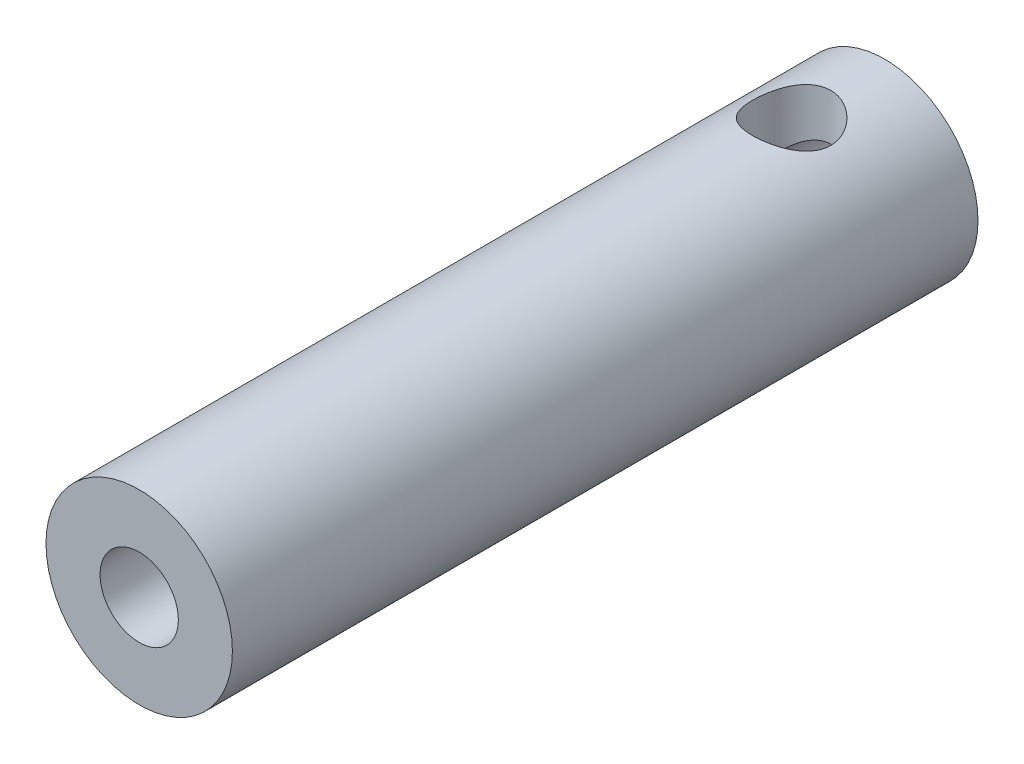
SolidWorks part; units mm, degrees
ref_plane "Piano frontale" through (0, 0, 0) normal (0, 0, 1) x (1, 0, 0)
ref_plane "Piano superiore" through (0, 0, 0) normal (0, 1, 0) x (1, 0, 0)
ref_plane "Piano destro" through (0, 0, 0) normal (1, 0, 0) x (0, 0, -1)
sketch "Schizzo1" plane through (0, 0, 0) normal (0, 0, 1) x (1, 0, 0)
  circle A0 centre (0, 0) radius 5
  dimension "D1" = 10
extrude "Estrusione-Estrusione1" add sketch "Schizzo1" along normal blind 40
hole_wizard "Foro filettato M5-1" positions "Schizzo2" profile "Schizzo3" tap size "M5" standard "ISO"
sketch "Schizzo2" plane through (0, 0, 40) normal (0, 0, 1) x (1, 0, 0)
  point P0 (0, 0)
sketch "Schizzo3" plane through (0, 0, 40) normal (1, 0, 0) x (0, -1, 0)
  line L0 (0, 0) -> (0, 16.2618)
  line L1 (0, 16.2618) -> (2.1, 15)
  line L2 (2.1, 15) -> (2.1, 0)
  line L5 (2.1, 0) -> (0, 0)
  line L10 (0, 16.2618) -> (-2.1, 15) construction
  line L11 (0, -6.35) -> (0, 107.95) construction
  dimension "Tap Drill Dia." = 4.2
  dimension "Tap Drill Depth" = 15
  dimension "Drill Angle" = 118
hole_wizard "Foro Ø5.0 (5)-1" positions "Schizzo4" profile "Schizzo5" hole size "Ø5.0" standard "ISO"
sketch "Schizzo4" plane through (0, 0, 0) normal (0, 0, -1) x (-1, 0, 0)
  point P0 (0, 0)
sketch "Schizzo5" plane through (0, 0, 0) normal (1, 0, 0) x (0, 1, 0)
  line L0 (0, 0) -> (0, 15)
  line L1 (0, 15) -> (2.5, 13.4978)
  line L2 (2.5, 13.4978) -> (2.5, 0)
  line L5 (2.5, 0) -> (0, 0)
  line L10 (0, 15) -> (-2.5, 13.4978) construction
  line L11 (0, -6.35) -> (0, 107.95) construction
  dimension "Hole Dia." = 5
  dimension "Hole Depth" = 15
  dimension "Drill Angle" = 118
ref_plane "Piano1" through (0, 5, 0) normal (0, 1, 0) x (1, 0, 0)
hole_wizard "Foro filettato M5-2" positions "Schizzo7" profile "Schizzo6" tap size "M5" standard "ISO"
sketch "Schizzo7" plane through (0, 5, 0) normal (0, 1, 0) x (1, 0, 0)
  point P0 (0, -5)
  dimension "D1" = 5
sketch "Schizzo6" plane through (0, 5, 5) normal (1, 0, 0) x (0, 0, 1)
  line L0 (0, 0) -> (0, 2.5)
  line L1 (0, 2.5) -> (2.1, 2.5)
  line L2 (2.1, 2.5) -> (2.1, 0)
  line L5 (2.1, 0) -> (0, 0)
  line L11 (0, -6.35) -> (0, 107.95) construction
  dimension "Thru Tap Drill Dia." = 4.2
  dimension "Thru Tap Drill Depth" = 2.5
